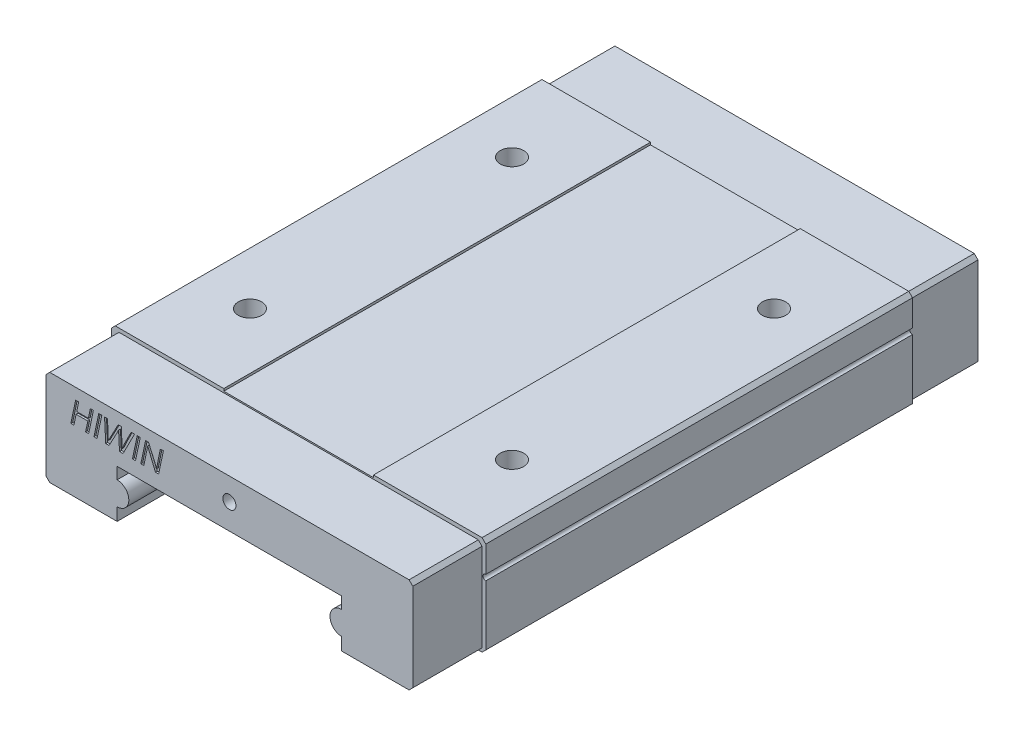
SolidWorks part; units mm, degrees
ref_plane "前视基准面" through (0, 0, 0) normal (0, 0, 1) x (1, 0, 0)
ref_plane "上视基准面" through (0, 0, 0) normal (0, 1, 0) x (1, 0, 0)
ref_plane "右视基准面" through (0, 0, 0) normal (1, 0, 0) x (0, 0, -1)
imported_body "输入1"
sketch "草图1" plane through (0, 14, 0) normal (0, 1, 0) x (1, 0, 0)
  circle A0 centre (14, 14) radius 2 construction
  circle A1 centre (-14, 14) radius 2 construction
  circle A2 centre (-14, -14) radius 2 construction
  circle A3 centre (14, -14) radius 2 construction
  circle A4 centre (14, 14) radius 2
  circle A5 centre (-14, 14) radius 2
  circle A6 centre (-14, -14) radius 2
  circle A7 centre (14, -14) radius 2
extrude "凸台-拉伸1" add sketch "草图1" against normal up to next
hole_wizard "M3 螺纹孔1" positions "草图3" profile "草图2" tap size "M3" standard "ISO"
sketch "草图3" plane through (0, 14, 0) normal (0, 1, 0) x (-1, 0, 0)
  line L0 (0, 0) -> (20, 0) construction
  line L1 (20, 22.8) -> (20, -22.8) construction
  line L3 (0, 0) -> (0, 30.2) construction
  line L4 (-19.2, 30.2) -> (19.2, 30.2) construction
  point P0 (14, 14)
  point P16 (14, -14)
  point P17 (-14, -14)
  point P18 (-14, 14)
  dimension "D1" = 28
  dimension "D2" = 28
sketch "草图2" plane through (-14, 14, 14) normal (1, 0, 0) x (0, 0, 1)
  line L0 (0, 0) -> (0, 5.8511)
  line L1 (0, 5.8511) -> (1.25, 5.1)
  line L2 (1.25, 5.1) -> (1.25, 0)
  line L5 (1.25, 0) -> (0, 0)
  line L10 (0, 5.8511) -> (-1.25, 5.1) construction
  line L11 (0, -6.35) -> (0, 107.95) construction
  dimension "螺纹孔钻头直径" = 2.5
  dimension "螺纹孔钻头深度" = 5.1
  dimension "导头角度" = 118
